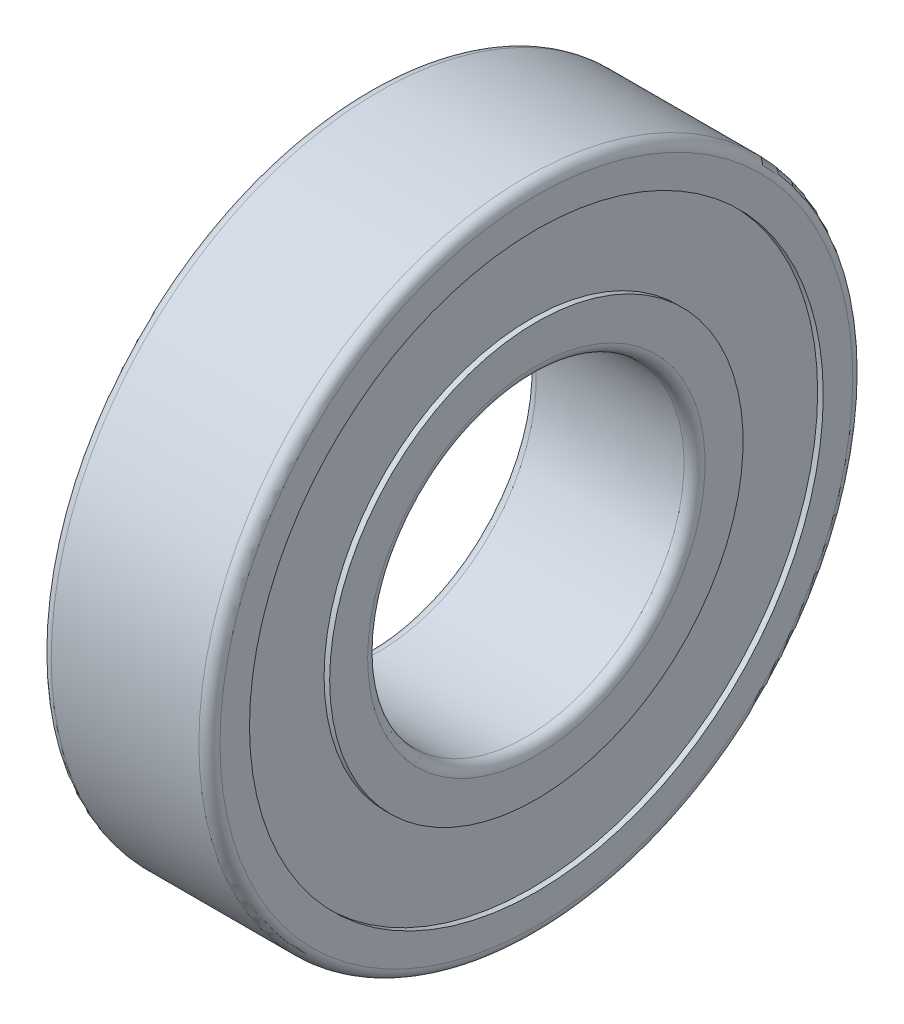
SolidWorks part; units mm, degrees
ref_plane "Front X-Y" through (0, 0, 0) normal (0, 0, 1) x (1, 0, 0)
ref_plane "Top X-Z" through (0, 0, 0) normal (0, 1, 0) x (1, 0, 0)
ref_plane "Right Y-Z" through (0, 0, 0) normal (1, 0, 0) x (0, 0, -1)
ref_plane "Plane1" through (0, 0, 0) normal (0, 0, 1) x (1, 0, 0)
sketch "Sketch1" plane through (0, 0, 0) normal (0, 0, 1) x (1, 0, 0)
  line L0 (0, 30) -> (0, 27.2)
  line L1 (0, 27.2) -> (0.53, 27.2)
  line L2 (0.53, 27.2) -> (0.53, 19.6)
  line L3 (0.53, 19.6) -> (0, 19.6)
  line L4 (0, 19.6) -> (0, 16)
  line L5 (1, 15) -> (15, 15)
  line L6 (16, 16) -> (16, 19.6)
  line L7 (16, 19.6) -> (15.47, 19.6)
  line L8 (15.47, 19.6) -> (15.47, 27.2)
  line L9 (15.47, 27.2) -> (16, 27.2)
  line L10 (16, 27.2) -> (16, 30)
  line L11 (15, 31) -> (1, 31)
  line L12 (16, 0) -> (0, 0) construction
  arc A0 (0, 16) -> (1, 15) centre (1, 16) ccw
  arc A1 (15, 15) -> (16, 16) centre (15, 16) ccw
  arc A2 (16, 30) -> (15, 31) centre (15, 30) ccw
  arc A3 (1, 31) -> (0, 30) centre (1, 30) ccw
revolve "Revolve1" add sketch "Sketch1" angle 360 about L12
